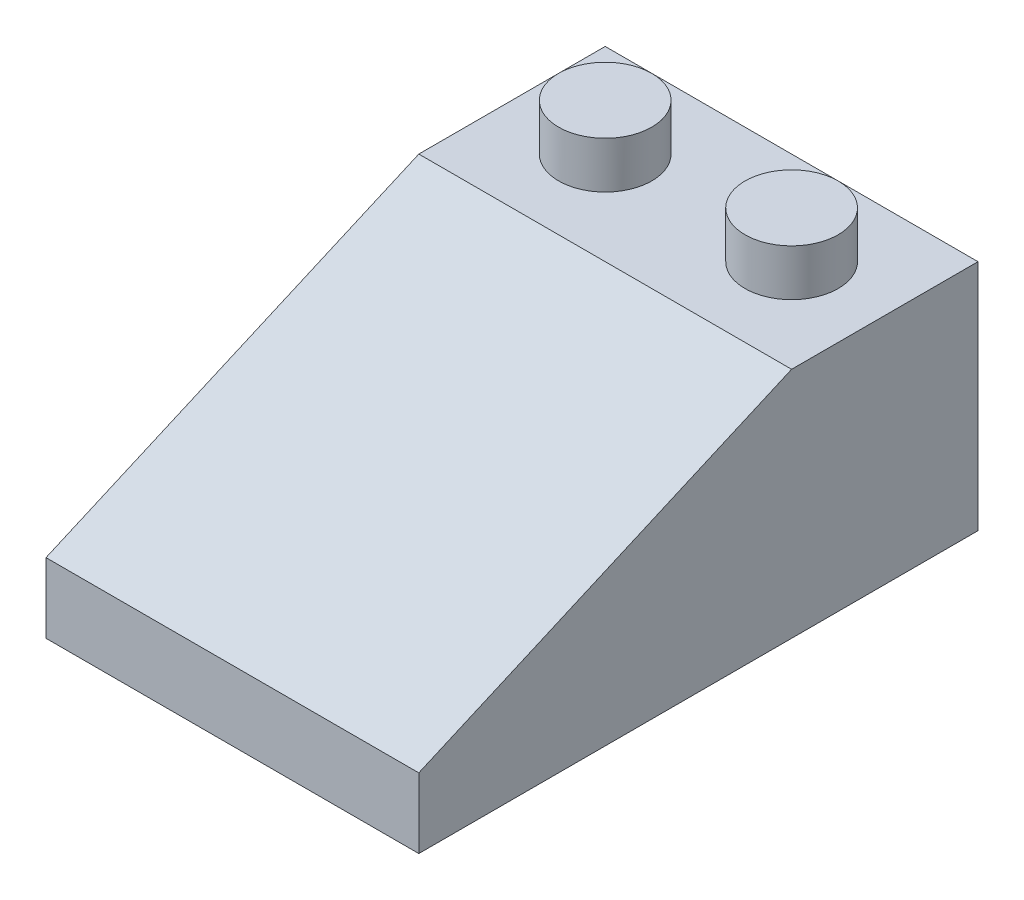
SolidWorks part; units mm, degrees
ref_plane "Front Plane" through (0, 0, 0) normal (0, 0, 1) x (1, 0, 0)
ref_plane "Top Plane" through (0, 0, 0) normal (0, 1, 0) x (1, 0, 0)
ref_plane "Right Plane" through (0, 0, 0) normal (1, 0, 0) x (0, 0, -1)
sketch "Croquis1" plane through (0, 0, 0) normal (1, 0, 0) x (0, 0, -1)
  line L0 (-8, 10) -> (-24, 3)
  line L1 (0, 0) -> (-24, 0)
  line L2 (0, 0) -> (0, 10)
  line L3 (0, 10) -> (-8, 10)
  line L4 (-24, 0) -> (-24, 3)
  dimension "D1" = 8
  dimension "D2" = 10
  dimension "D3" = 3
  dimension "D4" = 24
extrude "Saliente-Extruir1" add sketch "Croquis1" along normal blind 16
sketch "Croquis2" plane through (0, 10, 0) normal (0, 1, 0) x (1, 0, 0)
  line L0 (16, 0) -> (0, 0) construction
  line L1 (0, 0) -> (0, -8) construction
  line L2 (8, 0) -> (8, -1.5337) construction
  circle A0 centre (4, -4) radius 2
  circle A1 centre (12, -4) radius 2
  dimension "D1" = 4
  dimension "D2" = 4
  dimension "D3" = 4
extrude "Saliente-Extruir2" add sketch "Croquis2" along normal blind 2
shell "Vaciado1" thickness 1
sketch "Croquis6" plane through (0, 0, 0) normal (0, -1, 0) x (1, 0, 0)
  line L0 (16, 24) -> (16, 0) construction
  line L1 (16, 0) -> (0, 0) construction
  line L2 (1, 12) -> (15, 12) construction
  line L3 (1, 23) -> (1, 1) construction
  line L4 (15, 7.7908) -> (15, 23) construction
  circle A0 centre (8, 8) radius 2.7
  circle A1 centre (8, 8) radius 1.7
  circle A2 centre (8, 16) radius 1.7
  circle A3 centre (8, 16) radius 2.7
  dimension "D1" = 5.4
  dimension "D2" = 8
  dimension "D3" = 8
  dimension "D4" = 1
extrude "Saliente-Extruir3" add sketch "Croquis6" against normal up to next
